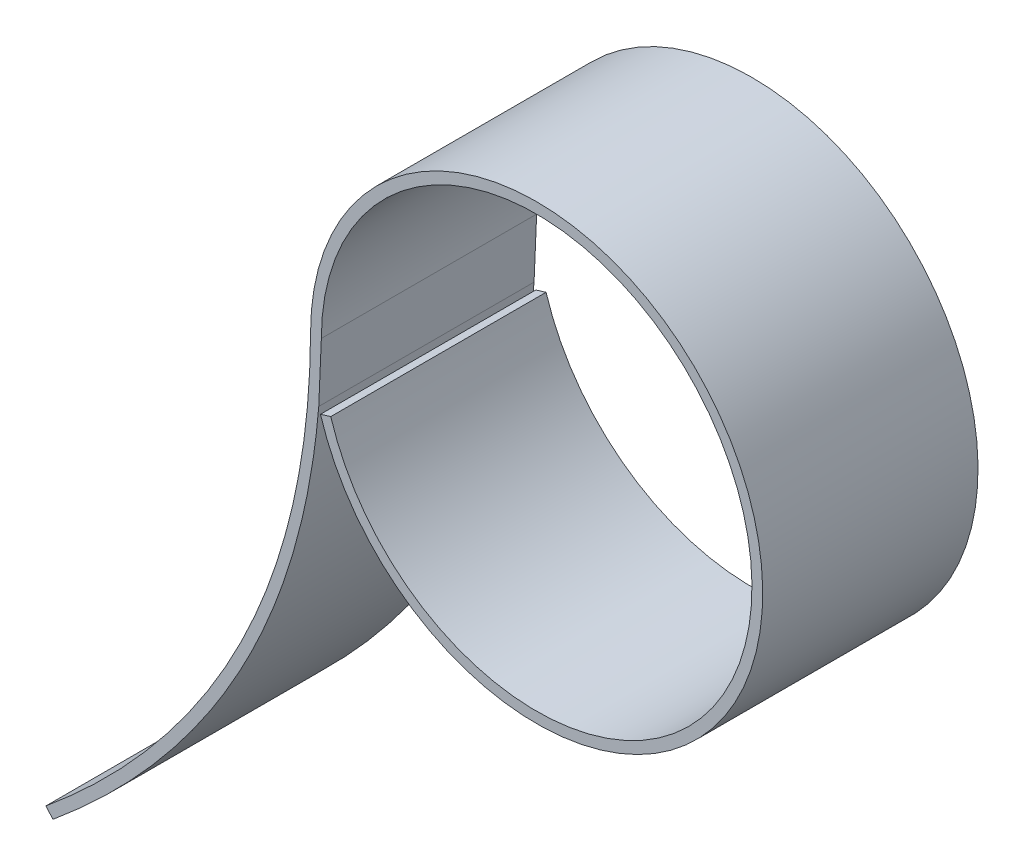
SolidWorks part; units mm, degrees
ref_plane "Front Plane" through (0, 0, 0) normal (0, 0, 1) x (1, 0, 0)
ref_plane "Top Plane" through (0, 0, 0) normal (0, 1, 0) x (1, 0, 0)
ref_plane "Right Plane" through (0, 0, 0) normal (1, 0, 0) x (0, 0, -1)
sketch "Sketch1" plane through (0, 0, 0) normal (0, 0, 1) x (1, 0, 0)
  line L0 (-45.5764, -50.3934) -> (-44.938, -51.1631)
  line L1 (-20.0809, -6.1447) -> (-19.1247, -5.8521)
  line L2 (-20.2412, -5.594) -> (-20, 0)
  arc A0 (-19.1247, -5.8521) -> (-20, 0) centre (0, 0) ccw
  arc A1 (-20.0809, -6.1447) -> (-21, 0) centre (0, 0) ccw
  circle A2 centre (0, 0) radius 21 construction
  circle A3 centre (0, 0) radius 20 construction
  spline S0 degree 2 poles (-21, 0) (-21.1541, -30.1387) (-45.5764, -50.3934) knots 0 0 0 1 1 1
  spline S1 degree 1 poles (-20, -0.0051) (-44.938, -51.1631) knots 0 0 1 1 construction
  spline S2 degree 3 poles (-20, -0.0051) (-20.0065, -1.2657) (-20.0836, -3.8032) (-20.4943, -8.7343) (-21.4895, -14.7233) (-23.4558, -21.5963) (-26.1939, -28.1588) (-29.7024, -34.4047) (-33.9758, -40.3294) (-38.1781, -45.0029) (-41.9079, -48.571) (-43.9206, -50.3193) (-44.938, -51.1631) knots 0 0 0 0 0.0625 0.125 0.25 0.375 0.5 0.625 0.75 0.875 0.9375 1 1 1 1 only from (-20.2412, -5.594) to (-44.938, -51.1631)
  dimension "D2" = 40
  dimension "D1" = 1
  dimension "D3" = 1
extrude "Extrude1" add sketch "Sketch1" along normal blind 20
